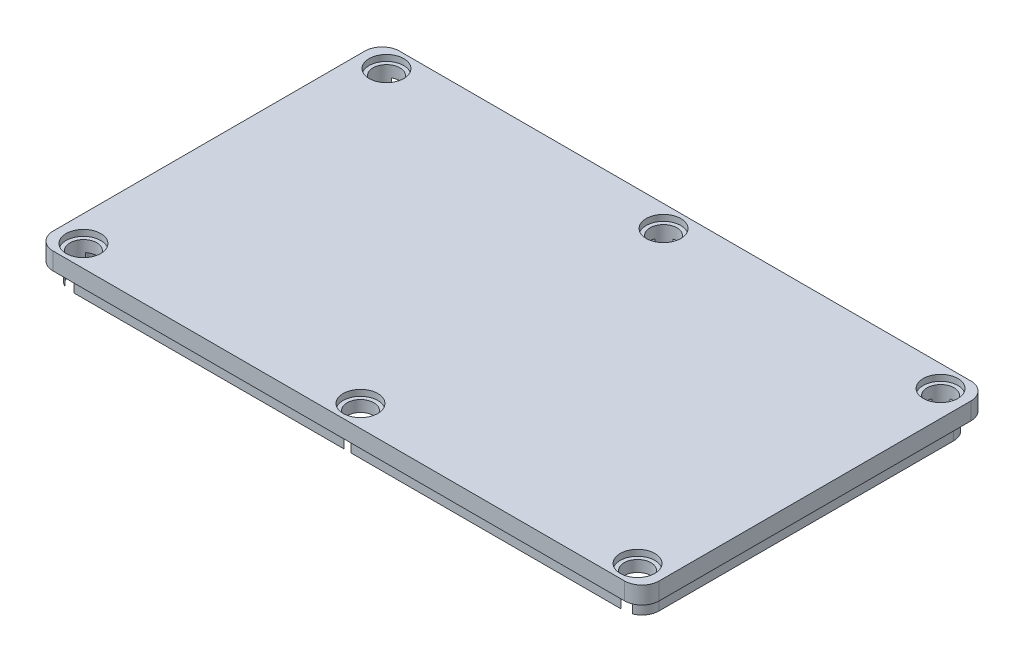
SolidWorks part; units mm, degrees
ref_plane "Front Plane" through (0, 0, 0) normal (0, 0, 1) x (1, 0, 0)
ref_plane "Top Plane" through (0, 0, 0) normal (0, 1, 0) x (1, 0, 0)
ref_plane "Right Plane" through (0, 0, 0) normal (1, 0, 0) x (0, 0, -1)
sketch "Sketch1" plane through (0, 0, 0) normal (0, 1, 0) x (1, 0, 0)
  line L1 (-33, -20) -> (33, -20)
  line L2 (-35, -18) -> (-35, 18)
  line L3 (-33, 20) -> (33, 20)
  line L4 (35, -18) -> (35, 18)
  line L5 (-35, -20) -> (35, 20) construction
  line L6 (-35, 20) -> (35, -20) construction
  arc A0 (-33, -20) -> (-35, -18) centre (-33, -18) cw
  arc A1 (33, -20) -> (35, -18) centre (33, -18) ccw
  arc A2 (33, 20) -> (35, 18) centre (33, 18) cw
  arc A3 (-35, 18) -> (-33, 20) centre (-33, 18) cw
  point P0 (0, 0)
  dimension "D3" = 2
  dimension "D1" = 70
  dimension "D2" = 40
extrude "Boss-Extrude1" add sketch "Sketch1" along normal blind 2
sketch "Sketch2" plane through (0, 0, 0) normal (0, -1, 0) x (1, 0, 0)
  line L0 (33, -20) -> (-33, -20) construction
  line L1 (32, -19) -> (-32, -19)
  line L2 (34, -17) -> (34, 17)
  line L3 (32, 19) -> (-32, 19)
  line L4 (-34, -17) -> (-34, 17)
  line L5 (-35, -18) -> (-35, 18) construction
  line L6 (-33, 20) -> (33, 20) construction
  line L7 (35, 18) -> (35, -18) construction
  line L9 (31, -18) -> (-31, -18)
  line L10 (-33, -16) -> (-33, 16)
  line L11 (31, 18) -> (-31, 18)
  line L12 (33, -16) -> (33, 16)
  line L13 (34, -19) -> (34, 19) construction
  line L14 (34, 19) -> (-34, 19) construction
  line L15 (33, 18) -> (-33, 18) construction
  line L16 (33, -18) -> (33, 18) construction
  line L17 (-33, -18) -> (-33, 18) construction
  line L18 (-34, -19) -> (-34, 19) construction
  line L19 (33, -18) -> (-33, -18) construction
  line L20 (34, -19) -> (-34, -19) construction
  arc A0 (34, 17) -> (32, 19) centre (32, 17) ccw
  arc A1 (31, 18) -> (33, 16) centre (31, 16) cw
  arc A2 (-33, 16) -> (-31, 18) centre (-31, 16) cw
  arc A3 (-32, 19) -> (-34, 17) centre (-32, 17) ccw
  arc A4 (-31, -18) -> (-33, -16) centre (-31, -16) cw
  arc A5 (-32, -19) -> (-34, -17) centre (-32, -17) cw
  arc A6 (31, -18) -> (33, -16) centre (31, -16) ccw
  arc A7 (32, -19) -> (34, -17) centre (32, -17) ccw
  dimension "D6" = 2
  dimension "D1" = 1
  dimension "D2" = 1
  dimension "D3" = 1
  dimension "D4" = 1
  dimension "D5" = 1
extrude "Boss-Extrude2" add sketch "Sketch2" along normal blind 2
sketch "Sketch3" plane through (0, 2, 0) normal (0, 1, 0) x (1, 0, 0)
  line L0 (-43.7225, 0) -> (52.5791, 0) construction
  line L1 (0, -25.7609) -> (0, 30.1313) construction
  circle A0 centre (-32, 17.5) radius 2
  circle A1 centre (0, 17.5) radius 2
  circle A2 centre (32, 17.5) radius 2
  circle A3 centre (32, -17.5) radius 2
  circle A4 centre (0, -17.5) radius 2
  circle A5 centre (-32, -17.5) radius 2
  circle A6 centre (-32, 17.5) radius 1.5
  circle A7 centre (0, 17.5) radius 1.5
  circle A8 centre (32, 17.5) radius 1.5
  circle A9 centre (32, -17.5) radius 1.5
  circle A10 centre (0, -17.5) radius 1.5
  circle A11 centre (-32, -17.5) radius 1.5
  dimension "D4" = 4
  dimension "D5" = 3
  dimension "D1" = 17.5
  dimension "D2" = 32
  dimension "D3" = 32
extrude "Cut-Extrude1" cut sketch "Sketch3" against normal blind 0.7
sketch "Sketch5" plane through (0, 2, 0) normal (0, 1, 0) x (1, 0, 0)
  circle A0 centre (-32, 17.5) radius 1.5 construction
  circle A1 centre (-32, 17.5) radius 1.5
  circle A2 centre (-32, -17.5) radius 1.5 construction
  circle A3 centre (0, -17.5) radius 1.5 construction
  circle A4 centre (32, -17.5) radius 1.5 construction
  circle A5 centre (32, 17.5) radius 1.5 construction
  circle A6 centre (0, 17.5) radius 1.5 construction
  circle A7 centre (-32, -17.5) radius 1.5
  circle A8 centre (0, -17.5) radius 1.5
  circle A9 centre (32, -17.5) radius 1.5
  circle A10 centre (32, 17.5) radius 1.5
  circle A11 centre (0, 17.5) radius 1.5
sketch "Sketch8" plane through (0, 2, 0) normal (0, 1, 0) x (1, 0, 0)
  circle A0 centre (-32, 17.5) radius 1.55
  dimension "D1" = 3.1
extrude "Cut-Extrude7" cut sketch "Sketch8" against normal blind 7
pattern_linear "LPattern1" count 3 spacing 32 along (1, 0, 0) count 2 spacing 35 along (0, 0, 1) of "Cut-Extrude7"
